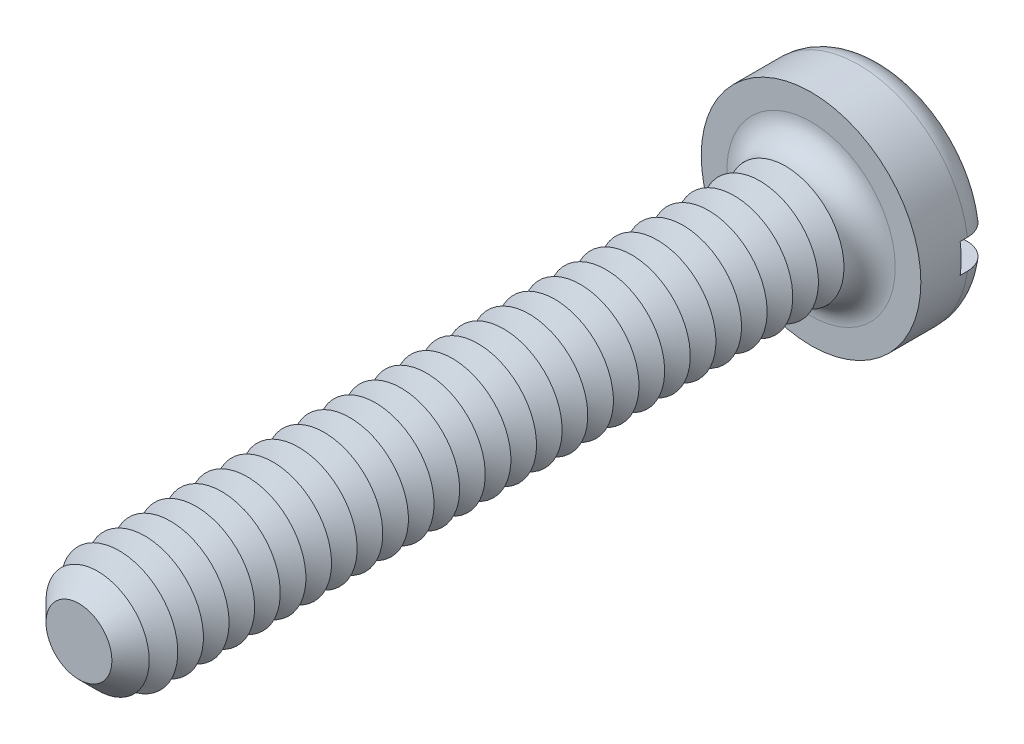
SolidWorks part; units mm, degrees
ref_plane "Front Plane" through (0, 0, 0) normal (0, 0, 1) x (1, 0, 0)
ref_plane "Top Plane" through (0, 0, 0) normal (0, 1, 0) x (1, 0, 0)
ref_plane "Right Plane" through (0, 0, 0) normal (1, 0, 0) x (0, 0, -1)
sketch "Sketch3" plane through (0, 0, 0) normal (0, 0, 1) x (1, 0, 0)
  circle A0 centre (0, 0) radius 1.5
  dimension "D1" = 3
extrude "Boss-Extrude2" add sketch "Sketch3" against normal blind 1
sketch "Sketch4" plane through (0, 0, 0) normal (0, 0, 1) x (1, 0, 0)
  circle A0 centre (0, 0) radius 0.8
  dimension "D1" = 1.6
extrude "Boss-Extrude3" add sketch "Sketch4" along normal blind 10
fillet "Fillet1" radius 0.35 2 edges at (1.5, 0, -1) (0.8, 0, 0)
chamfer "Chamfer1" distance 0.35 angle 45 1 edges at (0.8, 0, 10)
sketch "Sketch5" plane through (0, 0, 0) normal (1, 0, 0) x (0, 0, -1)
  line L0 (1.6944, 0) -> (-7.6738, 0) construction
sketch "Sketch6" plane through (0, 0, 0) normal (1, 0, 0) x (0, 0, -1)
  line L0 (-0.35, 0.8) -> (-0.525, 0.4969)
  line L1 (-0.525, 0.4969) -> (-0.7, 0.8)
  line L2 (-0.35, 0.8) -> (-9.65, 0.8) construction
  line L3 (-0.7, 0.8) -> (-0.35, 0.8)
  dimension "D1" = 0.35
revolve "Cut-Revolve1" cut sketch "Sketch6" angle 360 about L0
pattern_linear "LPattern1" count 27 spacing 0.35 along (0, 0, 1) of "Cut-Revolve1"
sketch "Sketch8" plane through (0, 0, -1) normal (0, 0, -1) x (-1, 0, 0)
  line L1 (1.5, -0.2) -> (-1.5, -0.2)
  line L2 (1.5, -0.2) -> (1.5, 0.2)
  line L3 (1.5, 0.2) -> (-1.5, 0.2)
  line L4 (-1.5, -0.2) -> (-1.5, 0.2)
  line L5 (1.5, -0.2) -> (-1.5, 0.2) construction
  line L6 (1.5, 0.2) -> (-1.5, -0.2) construction
  point P0 (0, 0)
  dimension "D1" = 3
  dimension "D2" = 0.4
extrude "Cut-Extrude1" cut sketch "Sketch8" against normal blind 0.45
